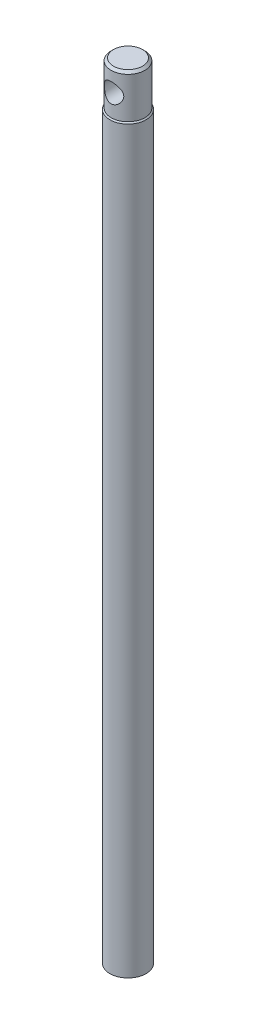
SolidWorks part; units mm, degrees
ref_plane "Plan de face" through (0, 0, 0) normal (0, 0, 1) x (1, 0, 0)
ref_plane "Plan de dessus" through (0, 0, 0) normal (0, 1, 0) x (1, 0, 0)
ref_plane "Plan de droite" through (0, 0, 0) normal (1, 0, 0) x (0, 0, -1)
sketch "Esquisse1" plane through (0, 0, 0) normal (0, 1, 0) x (1, 0, 0)
  circle A0 centre (0, 0) radius 15
  dimension "D1" = 30
extrude "Extrusion1" add sketch "Esquisse1" along normal blind 614
sketch "Esquisse2" plane through (0, 614, 0) normal (0, 1, 0) x (-1, 0, 0)
  circle A0 centre (0, 0) radius 14
  dimension "D1" = 28
extrude "Extrusion2" add sketch "Esquisse2" along normal blind 36
chamfer "Chanfrein1" distance 2 angle 45 1 edges at (0, 650, 14)
chamfer "Chanfrein2" distance 1 angle 45 1 edges at (0, 614, 15)
sketch "Esquisse3" plane through (0, 0, 0) normal (0, 0, 1) x (1, 0, 0)
  line L0 (12, 650) -> (-12, 650) construction
  circle A0 centre (0, 632) radius 8
  dimension "D1" = 16
  dimension "D2" = 18
extrude "Enlèv. mat.-Extru.1" cut sketch "Esquisse3" against normal through all and the other way through all
